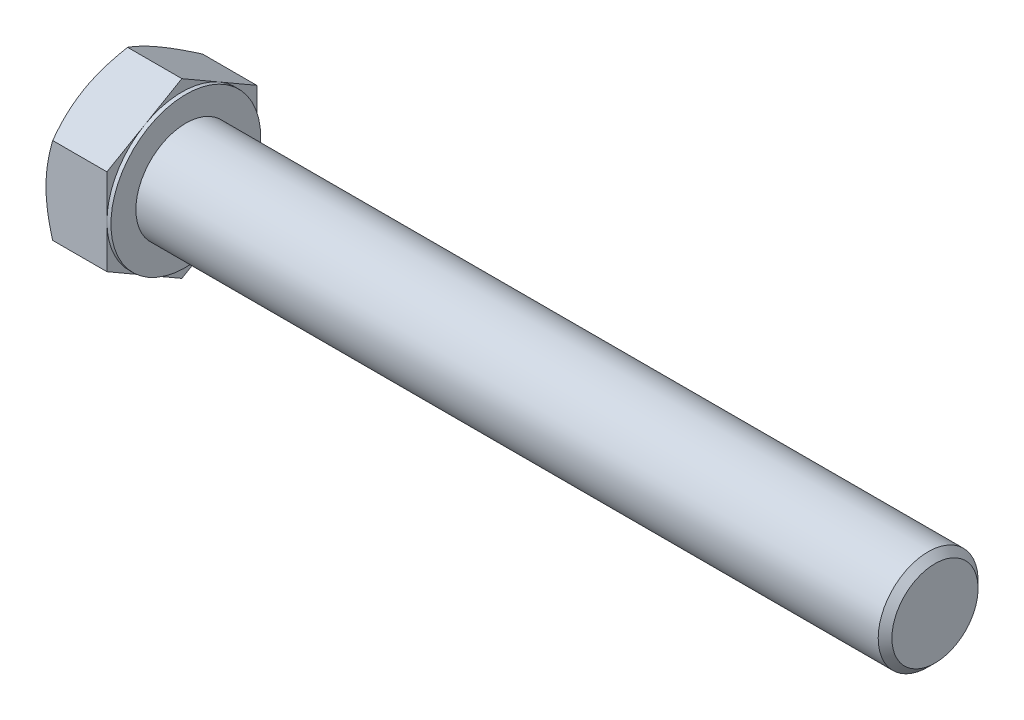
SolidWorks part; units mm, degrees
ref_plane "Plane1" through (0, 0, 0) normal (0, 0, 1) x (1, 0, 0)
ref_plane "Plane2" through (0, 0, 0) normal (0, 1, 0) x (1, 0, 0)
ref_plane "Plane3" through (0, 0, 0) normal (1, 0, 0) x (0, 0, -1)
sketch "HeadSke" plane through (0, 0, 0) normal (1, 0, 0) x (0, 0, -1)
  line L0 (15, 8.6603) -> (15, -8.6603)
  line L1 (-15, 8.6603) -> (-15, -8.6603)
  line L2 (15, -8.6603) -> (0, -17.3205)
  line L3 (0, -17.3205) -> (-15, -8.6603)
  line L4 (15, 8.6603) -> (0, 17.3205)
  line L5 (0, 17.3205) -> (-15, 8.6603)
  line L6 (0, 17.3205) -> (0, -17.3205) construction
  dimension "Width_flats" = 30
  dimension "D2" = 120
extrude "BaseHead" add sketch "HeadSke" along normal blind 13
sketch "BodySke" plane through (0, 0, 0) normal (0, 0, 1) x (1, 0, 0)
  line L0 (0, 8.6603) -> (0, -8.6603) construction
  line L1 (0, 0) -> (163, 0)
  line L2 (0, 0) -> (0, 10)
  line L3 (0, 10) -> (161.626, 10)
  line L4 (163, 0) -> (163, 8.626)
  line L5 (13, 17.3205) -> (13, 8.6603) construction
  line L6 (163, 8.626) -> (161.626, 10)
  line L7 (0, 0) -> (96.52, 0) construction
  line L8 (163, -8.626) -> (161.626, -10) construction
  line L9 (0, -10) -> (161.626, -10) construction
  line L10 (15.5, 15.24) -> (15.5, -1.27) construction
  line L11 (108, 6.8002) -> (108, -5.502) construction
  line L12 (13, 8.6603) -> (13, -8.6603) construction
  dimension "Length" = 150
  dimension "Body_ch_ang" = 45
  dimension "Diameter" = 20
  dimension "Minor_dia" = 17.252
  dimension "Advance" = 2.5
  dimension "Thread_nom" = 55
revolve "BaseBody" add sketch "BodySke"
fillet "HeadFillet" [suppressed] radius 0.8
sketch "Sketch3" plane through (0, 0, 0) normal (0, 1, 0) x (1, 0, 0)
  line L0 (3.75, 21.4952) -> (-3.75, 8.5048)
  line L1 (3.75, 21.4952) -> (-8.3048, 28.455)
  line L2 (-3.75, 8.5048) -> (-15.8048, 15.4646)
  line L3 (-8.3048, 28.455) -> (-15.8048, 15.4646)
  line L4 (0, 15) -> (0, 0) construction
  line L6 (0, 0) -> (99.06, 0) construction
  dimension "D1" = 13.9196
  dimension "Head_ch_ang" = 30
revolve "HeadChamfer" cut sketch "Sketch3" angle 360 about L6
sketch "BearingSke" plane through (0, 0, 0) normal (0, 0, 1) x (1, 0, 0)
  line L0 (13, 17.3205) -> (1.3397, 17.3205) construction
  line L1 (13, 17.3205) -> (13, 8.6603) construction
  line L2 (13, 15) -> (12.2, 15)
  line L3 (13, 15) -> (13, 17.3205)
  line L4 (13, 17.3205) -> (12.2, 17.3205)
  line L5 (0, 0) -> (95.25, 0) construction
  line L6 (0, 0) -> (96.52, 0) construction
  line L7 (12.2, 15) -> (12.2, 17.3205)
  dimension "Bearing_ht" = 0.8
  dimension "Bearing_dia" = 30
revolve "BearingFace" cut sketch "BearingSke" angle 360 about L5
sketch "ThdSchSke" plane through (0, 0, 0) normal (0, 0, 1) x (1, 0, 0)
  line L0 (108, -8.626) -> (107.0379, -10)
  line L1 (108, -8.626) -> (108.9621, -10)
  line L2 (108.9621, -10) -> (108.9621, -12.5)
  line L3 (-3.175, 0) -> (5.1513, 0) construction
  line L5 (108.9621, -12.5) -> (107.0379, -12.5)
  line L6 (107.0379, -12.5) -> (107.0379, -10)
  dimension "Thread_minor" = 17.252
  dimension "Diameter" = 20
  dimension "Start" = 108
  dimension "SideAngle" = 55
  dimension "VeeAngle" = 70
  dimension "Overcut" = 25
revolve "ThreadSchematic" [suppressed] cut sketch "ThdSchSke" angle 360 about L3
pattern_linear "ThdSchPat" [suppressed]
equation "\"Thread_minor@ThreadCosmetic\" = \"Minor_dia@BodySke\""
equation "\"Thread_length@ThreadCosmetic\" = ((sgn( (\"Length@BodySke\" - \"Advance@BodySke\" * 2.0 ) - \"Thread_nom@BodySke\" )-1)*( (\"Length@BodySke\" - \"Advance@BodySke\" * 2.0 ) - \"Thread_nom@BodySke\" ))/-2+ \"Thread_"
equation "\"Thread_minor@ThdSchSke\" = \"Minor_dia@BodySke\""
equation "\"Diameter@ThdSchSke\" = \"Diameter@BodySke\""
equation "\"Overcut@ThdSchSke\" = \"Diameter@BodySke\" * 1.25"
equation "\"Start@ThdSchSke\" = \"Head_ht@BaseHead\" + \"Length@BodySke\" - \"Thread_length@ThreadCosmetic\"  '---Non-countersunk---"
equation "\"Num_threads@ThdSchPat\" = int( \"Thread_length@ThreadCosmetic\" / \"Advance@BodySke\" + 0.999 )  + 1"
equation "\"Advance@ThdSchPat\" = \"Thread_length@ThreadCosmetic\" /  (\"Num_threads@ThdSchPat\" - 1) 'relax it"
equation "\"Num_threads@ThdSchPat\" = \"Num_threads@ThdSchPat\" - sgn( \"Num_threads@ThdSchPat\" - 1) '---chamfered tips only---"
